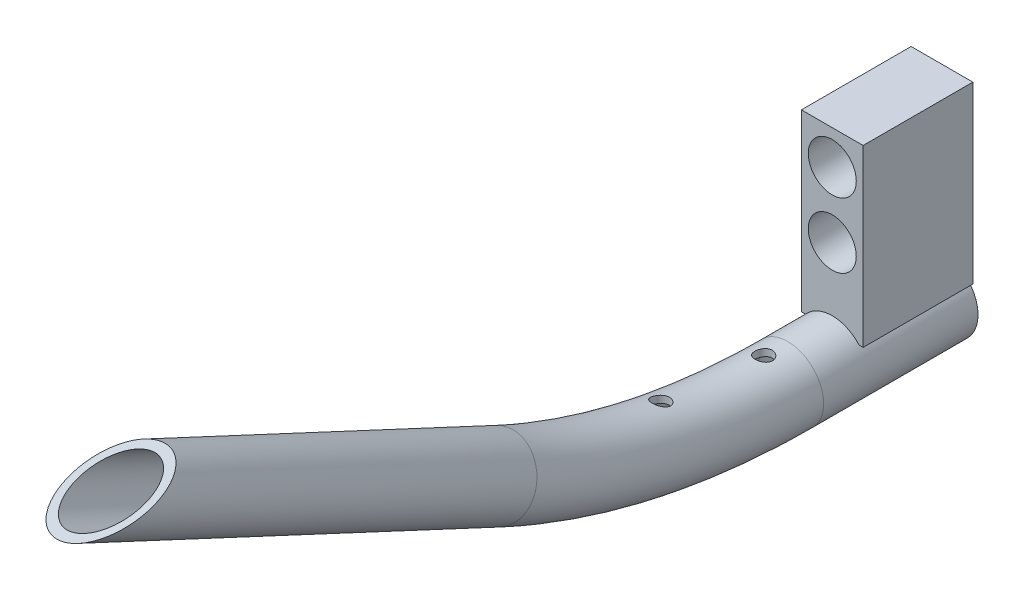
SolidWorks part; units mm, degrees
ref_plane "Plan de face" through (0, 0, 0) normal (0, 0, 1) x (1, 0, 0)
ref_plane "Plan de dessus" through (0, 0, 0) normal (0, 1, 0) x (1, 0, 0)
ref_plane "Plan de droite" through (0, 0, 0) normal (1, 0, 0) x (0, 0, -1)
sketch "Esquisse1" plane through (0, 0, 0) normal (0, 0, 1) x (1, 0, 0)
  circle A0 centre (0, 0) radius 10.5
  circle A1 centre (0, 0) radius 8.5
  dimension "D1" = 21
  dimension "D2" = 17
sketch "Esquisse2" plane through (0, 0, 0) normal (1, 0, 0) x (0, 0, -1)
  line L0 (0, 0) -> (-45, 0)
  line L1 (0, 10.5) -> (0, -10.5) construction
  line L2 (-129.5237, 18.7384) -> (-253.6779, 76.6325)
  arc A0 (-45, 0) -> (-129.5237, 18.7384) centre (-45, 200) cw
  dimension "D1" = 200
  dimension "D2" = 45
  dimension "D3" = 25
  dimension "D4" = 265
sweep "Balayage1" add profiles "Esquisse1" path "Esquisse2"
sketch "Esquisse5" plane through (0, 0, 0) normal (1, 0, 0) x (0, 0, -1)
  line L0 (-258.1154, 67.1163) -> (-227.89, 131.9347) construction
  line L2 (-121.8251, 89.5325) -> (-121.8251, 53.1144) construction
  line L3 (-258.1154, 67.1163) -> (-221.1178, 77.0297)
  line L4 (0, 0) -> (-277.0102, 0) construction
  line L5 (-221.1178, 77.0297) -> (-227.9273, 102.4432)
  line L6 (-227.9273, 102.4432) -> (-264.9249, 92.5297)
  line L7 (-264.9249, 92.5297) -> (-258.1154, 67.1163)
  dimension "D1" = 25
  dimension "D2" = 50
extrude "Extrusion1" cut sketch "Esquisse5" against normal mid plane 30
sketch "Esquisse6" plane through (0, 0, 0) normal (0, 1, 0) x (1, 0, 0)
  line L0 (0, 0) -> (0, -115.9839) construction
  line L1 (10.5, 0) -> (-10.5, 0) construction
  line L2 (8.5, 0) -> (-8.5, 0) construction
  circle A0 centre (0, -82) radius 2.5
  circle A1 centre (0, -52) radius 2.5
  dimension "D1" = 5
  dimension "D2" = 5
  dimension "D3" = 52
  dimension "D4" = 82
extrude "Extrusion2" cut sketch "Esquisse6" along normal blind 21
sketch "Esquisse7" plane through (0, 0, 0) normal (0, 0, -1) x (-1, 0, 0)
  line L0 (0, 0) -> (0, 63.1156) construction
  line L1 (-9, 58) -> (9, 58)
  line L2 (-9, 58) -> (-9, 7)
  line L3 (-9, 7) -> (-7.8262, 7)
  line L5 (9, 7) -> (7.8262, 7)
  line L6 (9, 58) -> (9, 7)
  circle A0 centre (0, 0) radius 10.5 construction
  arc A1 (7.8262, 7) -> (-7.8262, 7) centre (0, 0) ccw
  circle A2 centre (0, 48) radius 4.25
  circle A3 centre (0, 29) radius 4.25
  dimension "D3" = 7
  dimension "D4" = 8.5
  dimension "D5" = 8.5
  dimension "D1" = 51
  dimension "D2" = 10
  dimension "D6" = 29
extrude "Extrusion3" add sketch "Esquisse7" against normal blind 32
sketch "Esquisse8" plane through (0, 0, 32) normal (0, 0, 1) x (1, 0, 0)
  circle A0 centre (0, 48) radius 7
  circle A1 centre (0, 29) radius 7
  dimension "D1" = 14
  dimension "D2" = 14
extrude "Extrusion4" cut sketch "Esquisse8" against normal blind 11
